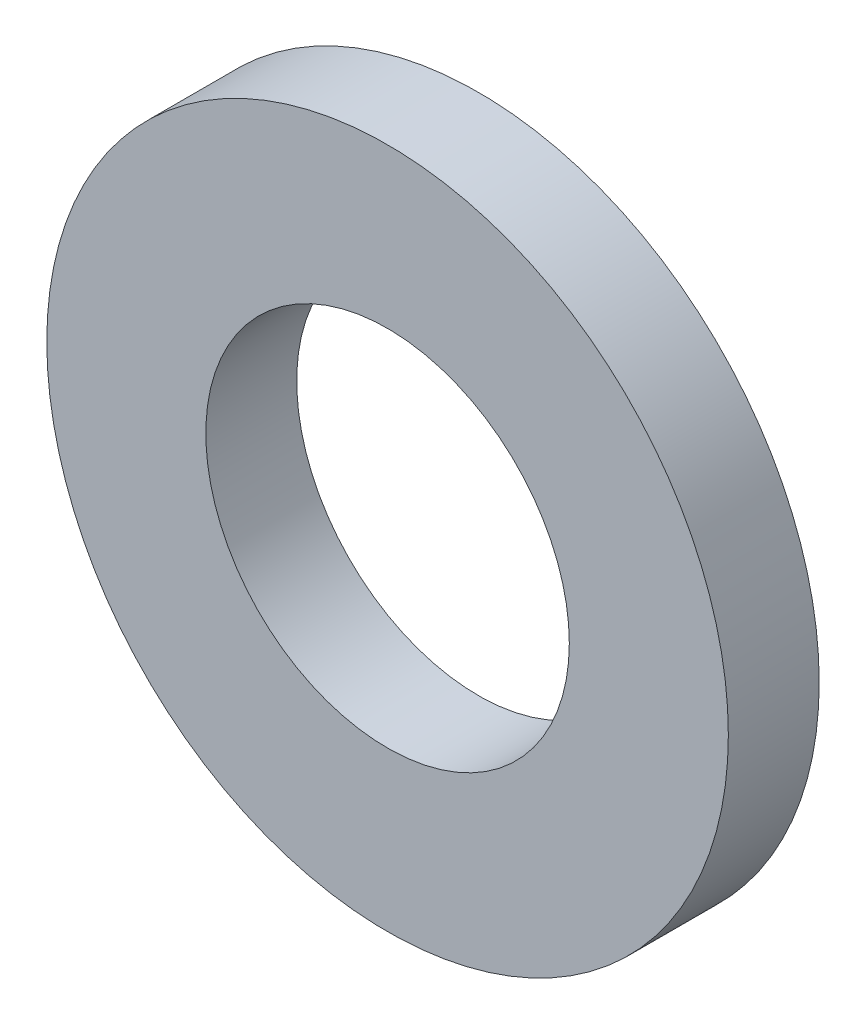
SolidWorks part; units mm, degrees
ref_plane "Alzado" through (0, 0, 0) normal (0, 0, 1) x (1, 0, 0)
ref_plane "Planta" through (0, 0, 0) normal (0, 1, 0) x (1, 0, 0)
ref_plane "Vista lateral" through (0, 0, 0) normal (1, 0, 0) x (0, 0, -1)
sketch "Croquis1" plane through (0, 0, 0) normal (0, 0, 1) x (1, 0, 0)
  circle A0 centre (0, 0) radius 4
  circle A1 centre (0, 0) radius 7.5
  dimension "D1" = 8
  dimension "D2" = 15
extrude "Saliente-Extruir1" add sketch "Croquis1" along normal mid plane 2
